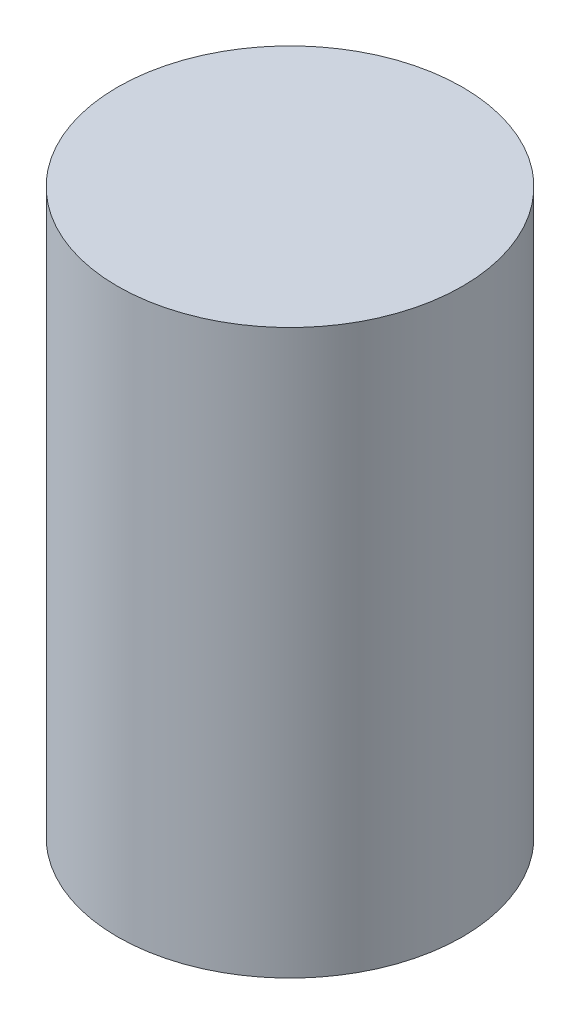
SolidWorks part; units mm, degrees
ref_plane "Plan de face" through (0, 0, 0) normal (0, 0, 1) x (1, 0, 0)
ref_plane "Plan de dessus" through (0, 0, 0) normal (0, 1, 0) x (1, 0, 0)
ref_plane "Plan de droite" through (0, 0, 0) normal (1, 0, 0) x (0, 0, -1)
sketch "Esquisse1" plane through (0, 0, 0) normal (0, 1, 0) x (1, 0, 0)
  circle A0 centre (0, 0) radius 75
  circle A1 centre (0, 0) radius 60
  dimension "D1" = 150
  dimension "D2" = 120
extrude "Boss.-Extru.1" add sketch "Esquisse1" along normal blind 215
sketch "Esquisse2" plane through (0, 215, 0) normal (0, 1, 0) x (1, 0, 0)
  circle A0 centre (0, 0) radius 75
  dimension "D1" = 150
extrude "Boss.-Extru.3" add sketch "Esquisse2" along normal blind 30
